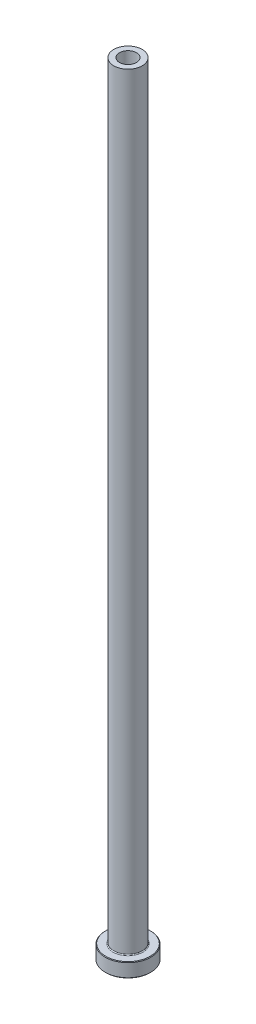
SolidWorks part; units mm, degrees
ref_plane "Front Plane" through (0, 0, 0) normal (0, 0, 1) x (1, 0, 0)
ref_plane "Top Plane" through (0, 0, 0) normal (0, 1, 0) x (1, 0, 0)
ref_plane "Right Plane" through (0, 0, 0) normal (1, 0, 0) x (0, 0, -1)
sketch "Sketch1" plane through (0, 0, 0) normal (0, 0, 1) x (1, 0, 0)
  line L0 (-3, 275) -> (-5, 275)
  line L1 (-5, 275) -> (-5, 5)
  line L2 (-5, 5) -> (-8, 5)
  line L3 (-8, 5) -> (-8, 0)
  line L4 (8.8, 0) -> (-8.8, 0) construction
  line L5 (-8, 0) -> (-3.25, 0)
  line L6 (-3, 230) -> (-3, 275)
  line L7 (0, 92.1877) -> (0, -15.5353) construction
  line L8 (0, -8.8) -> (0, 8.8) construction
  line L9 (-3, 230) -> (-3.25, 218)
  line L10 (-3.25, 218) -> (-3.25, 0)
  dimension "D1" = 0.25
  dimension "ID" = 6
  dimension "OD" = 10
  dimension "L" = 275
  dimension "H" = 16
  dimension "T" = 5
  dimension "N" = 45
  dimension "D2" = 12
revolve "Revolve1" add sketch "Sketch1" angle 360 about L7
fillet "Fillet1" radius 0.3 1 edges at (0, 5, 5)
chamfer "Chamfer1" distance 0.2 angle 45 2 edges at (0, 5, 8) (0, 0, 8)
chamfer "Chamfer3" distance 0.5 angle 45 1 edges at (0, 0, 3.25)
